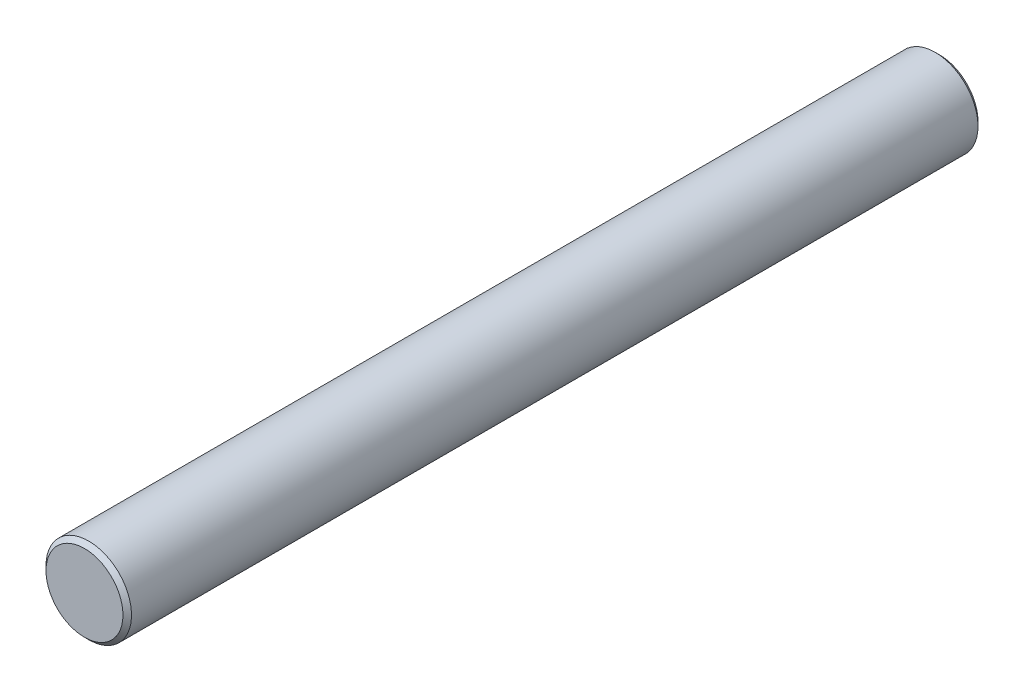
SolidWorks part; units mm, degrees
ref_plane "Face" through (0, 0, 0) normal (0, 0, 1) x (1, 0, 0)
ref_plane "Dessus" through (0, 0, 0) normal (0, 1, 0) x (1, 0, 0)
ref_plane "Droite" through (0, 0, 0) normal (1, 0, 0) x (0, 0, -1)
sketch "Esquisse1" plane through (0, 0, 0) normal (0, 0, 1) x (1, 0, 0)
  circle A0 centre (0, 0) radius 5
  dimension "D1" = 10
extrude "Extrusion1" add sketch "Esquisse1" along normal blind 100
chamfer "Chanfrein1" distance 0.5 angle 45 2 edges at (5, 0, 0) (5, 0, 100)
